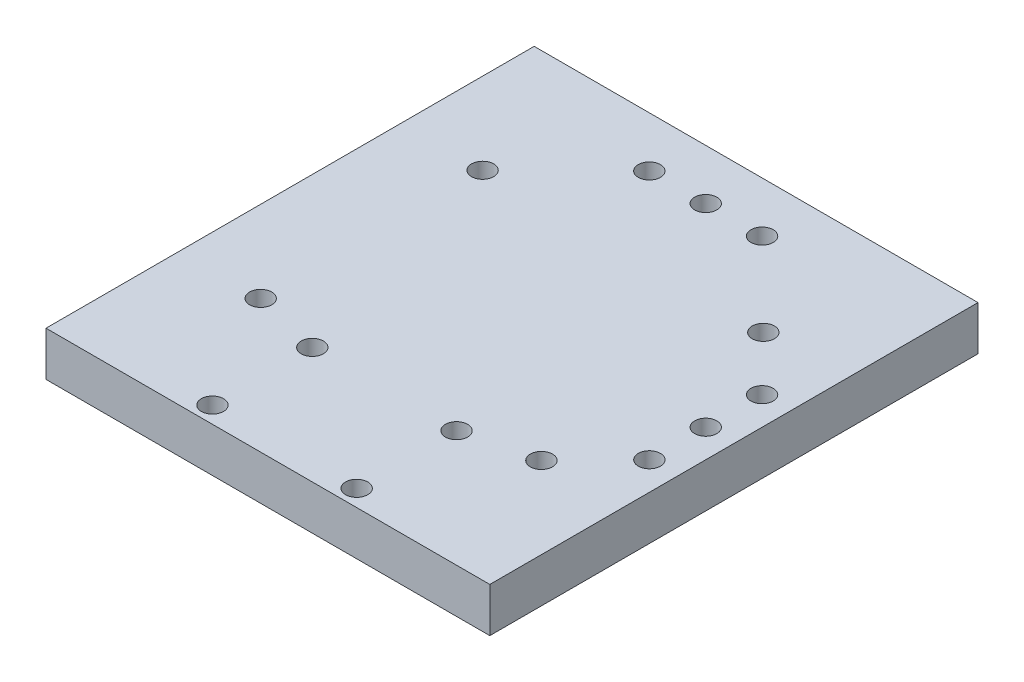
SolidWorks part; units mm, degrees
ref_plane "Alzado" through (0, 0, 0) normal (0, 0, 1) x (1, 0, 0)
ref_plane "Planta" through (0, 0, 0) normal (0, 1, 0) x (1, 0, 0)
ref_plane "Vista lateral" through (0, 0, 0) normal (1, 0, 0) x (0, 0, -1)
sketch "Croquis1" plane through (0, 0, 0) normal (0, 1, 0) x (1, 0, 0)
  line L0 (-2.54, 8.73) -> (2.54, 8.73) construction
  line L5 (8.73, -2.54) -> (8.73, 2.54) construction
  line L6 (-3.25, -5.75) -> (3.25, -5.75) construction
  line L7 (-6.325, -5) -> (6.325, -5) construction
  line L8 (-6.325, -5) -> (-6.325, 5) construction
  line L9 (-6.325, 5) -> (6.325, 5) construction
  line L10 (6.325, -5) -> (6.325, 5) construction
  line L11 (-6.325, -5) -> (6.325, 5) construction
  line L12 (-6.325, 5) -> (6.325, -5) construction
  line L13 (-3.25, -10.25) -> (3.25, -10.25) construction
  line L14 (-3.25, -10.25) -> (-3.25, -5.75) construction
  line L15 (-3.25, -5.75) -> (3.25, -5.75) construction
  line L16 (3.25, -10.25) -> (3.25, -5.75) construction
  line L17 (-3.25, -10.25) -> (3.25, -5.75) construction
  line L18 (-3.25, -5.75) -> (3.25, -10.25) construction
  line L20 (-10, -11) -> (10, -11)
  line L21 (-10, -11) -> (-10, 11)
  line L22 (-10, 11) -> (10, 11)
  line L23 (10, -11) -> (10, 11)
  line L24 (-10, -11) -> (10, 11) construction
  line L25 (-10, 11) -> (10, -11) construction
  circle A0 centre (0, 8.73) radius 0.5
  circle A1 centre (8.73, 0) radius 0.5
  circle A2 centre (-6.325, 5) radius 0.5
  circle A3 centre (6.325, 5) radius 0.5
  circle A4 centre (6.325, -5) radius 0.5
  circle A5 centre (-6.325, -5) radius 0.5
  circle A6 centre (2.54, 8.73) radius 0.5
  circle A7 centre (-2.54, 8.73) radius 0.5
  circle A8 centre (8.73, 2.54) radius 0.5
  circle A9 centre (8.73, -2.54) radius 0.5
  circle A10 centre (-3.25, -5.75) radius 0.5
  circle A11 centre (3.25, -5.75) radius 0.5
  circle A12 centre (3.25, -10.25) radius 0.5
  circle A13 centre (-3.25, -10.25) radius 0.5
  point P0 (0, 0)
  point P12 (0, 0)
  point P14 (0, 8.73)
  point P22 (8.73, 0)
  point P26 (0, -8)
  point P31 (0, 0)
  dimension "D2" = 1
  dimension "D1" = 2
  dimension "D3" = 10
  dimension "D4" = 12.65
  dimension "D5" = 8.73
  dimension "D6" = 8.73
  dimension "D8" = 2.54
  dimension "D9" = 6.5
  dimension "D10" = 4.5
  dimension "D11" = 8
  dimension "D14" = 6.5
  dimension "D15" = 22
  dimension "D16" = 20
  dimension "D7" = 2
  dimension "D12" = 2
  dimension "D13" = 2
extrude "Saliente-Extruir1" add sketch "Croquis1" along normal blind 2
